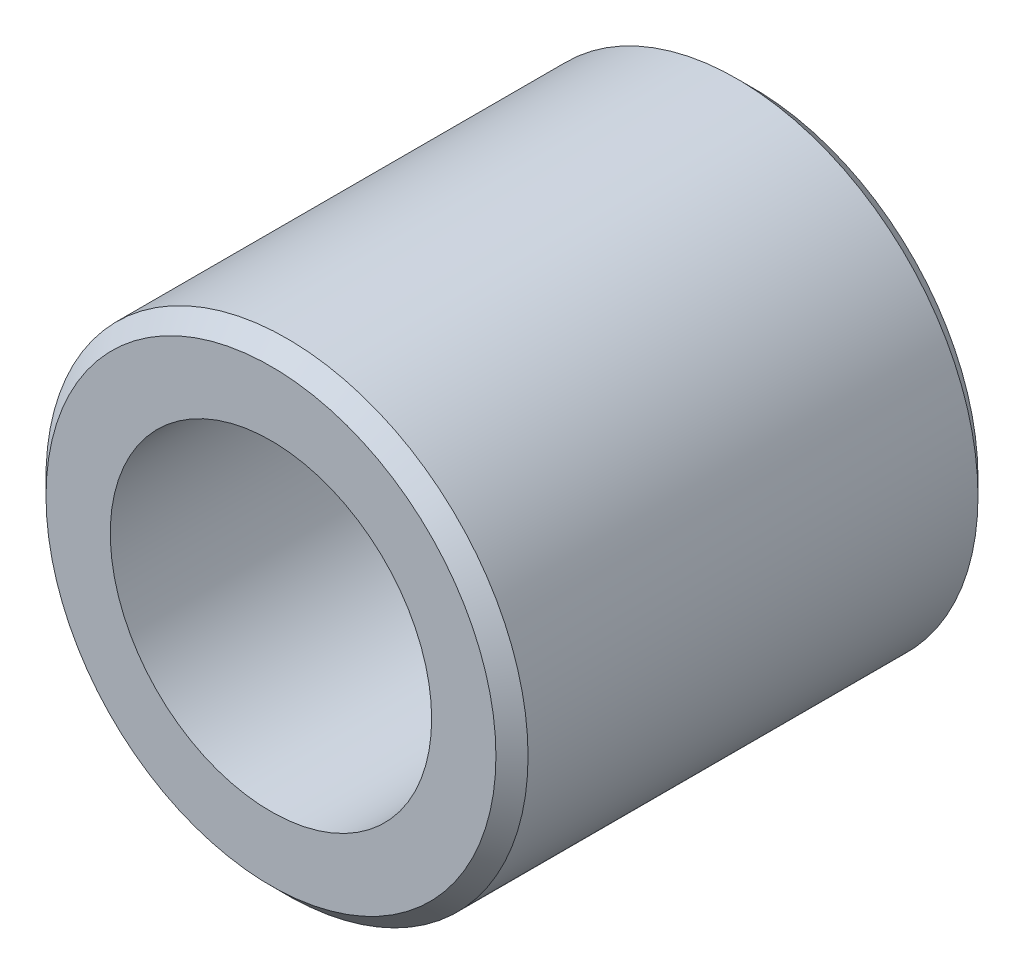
SolidWorks part; units mm, degrees
ref_plane "Front Plane" through (0, 0, 0) normal (0, 0, 1) x (1, 0, 0)
ref_plane "Top Plane" through (0, 0, 0) normal (0, 1, 0) x (1, 0, 0)
ref_plane "Right Plane" through (0, 0, 0) normal (1, 0, 0) x (0, 0, -1)
sketch "Sketch1" plane through (0, 0, 0) normal (0, 0, 1) x (1, 0, 0)
  circle A0 centre (0, 0) radius 15
  circle A1 centre (0, 0) radius 10
  dimension "D1" = 30
  dimension "D2" = 20
extrude "Boss-Extrude1" add sketch "Sketch1" along normal blind 30
chamfer "Chamfer1" distance 1 angle 45 2 edges at (15, 0, 0) (15, 0, 30)
scale "Scale1" scale about centroid uniform scaling yes scale factor 0.75
